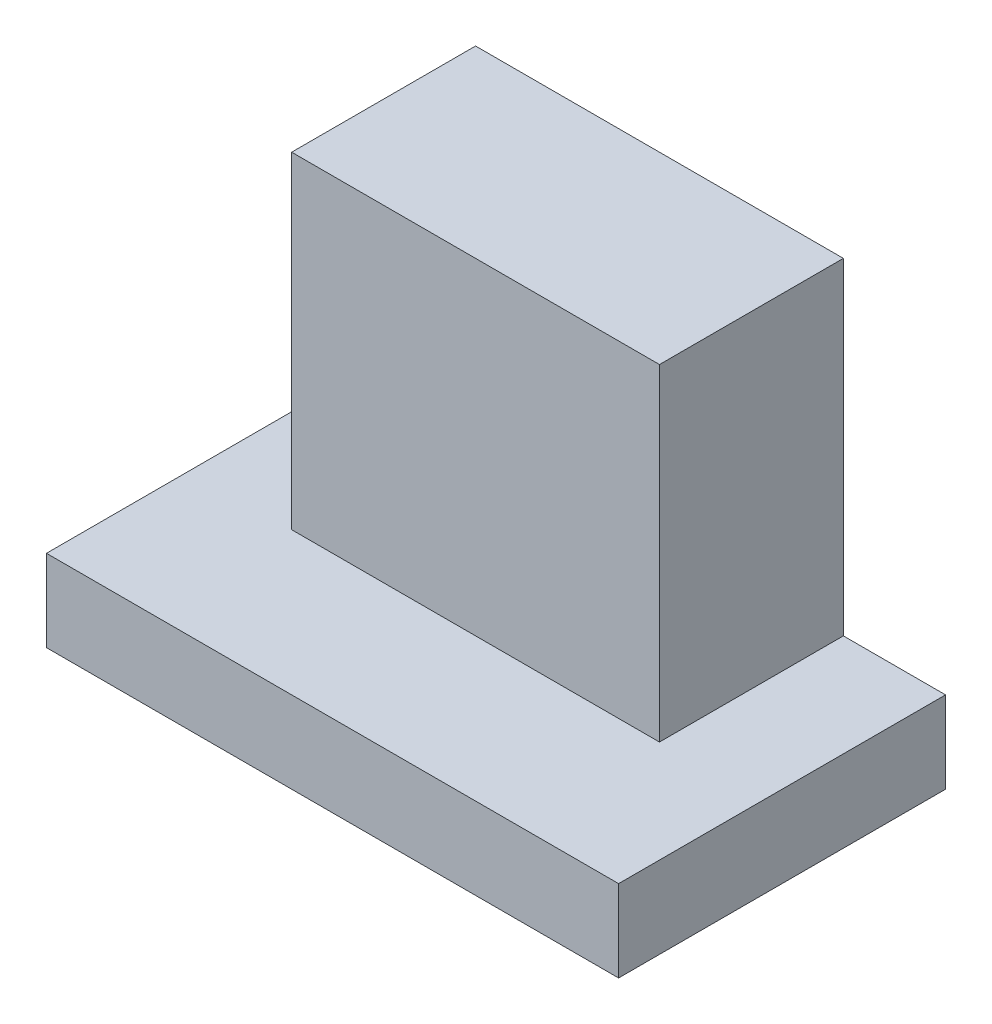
SolidWorks part; units mm, degrees
ref_plane "前视基准面" through (0, 0, 0) normal (0, 0, 1) x (1, 0, 0)
ref_plane "上视基准面" through (0, 0, 0) normal (0, 1, 0) x (1, 0, 0)
ref_plane "右视基准面" through (0, 0, 0) normal (1, 0, 0) x (0, 0, -1)
sketch "草图1" plane through (0, 0, 0) normal (0, 1, 0) x (1, 0, 0)
  line L0 (0, 0) -> (0, -101.1621) construction
  line L1 (-70, 0) -> (70, 0)
  line L2 (-70, 0) -> (-70, -80)
  line L3 (-70, -80) -> (70, -80)
  line L4 (70, 0) -> (70, -80)
  dimension "D1" = 140
  dimension "D2" = 80
extrude "拉伸1" add sketch "草图1" along normal blind 20
sketch "草图2" plane through (0, 20, 0) normal (0, 1, 0) x (1, 0, 0)
  line L0 (70, 0) -> (-70, 0) construction
  line L1 (-45, 0) -> (45, 0)
  line L2 (-45, 0) -> (-45, -45)
  line L3 (-45, -45) -> (45, -45)
  line L4 (45, 0) -> (45, -45)
  line L5 (0, 0) -> (0, -65.2554) construction
  dimension "D1" = 90
  dimension "D2" = 45
extrude "拉伸2" add sketch "草图2" along normal blind 80
